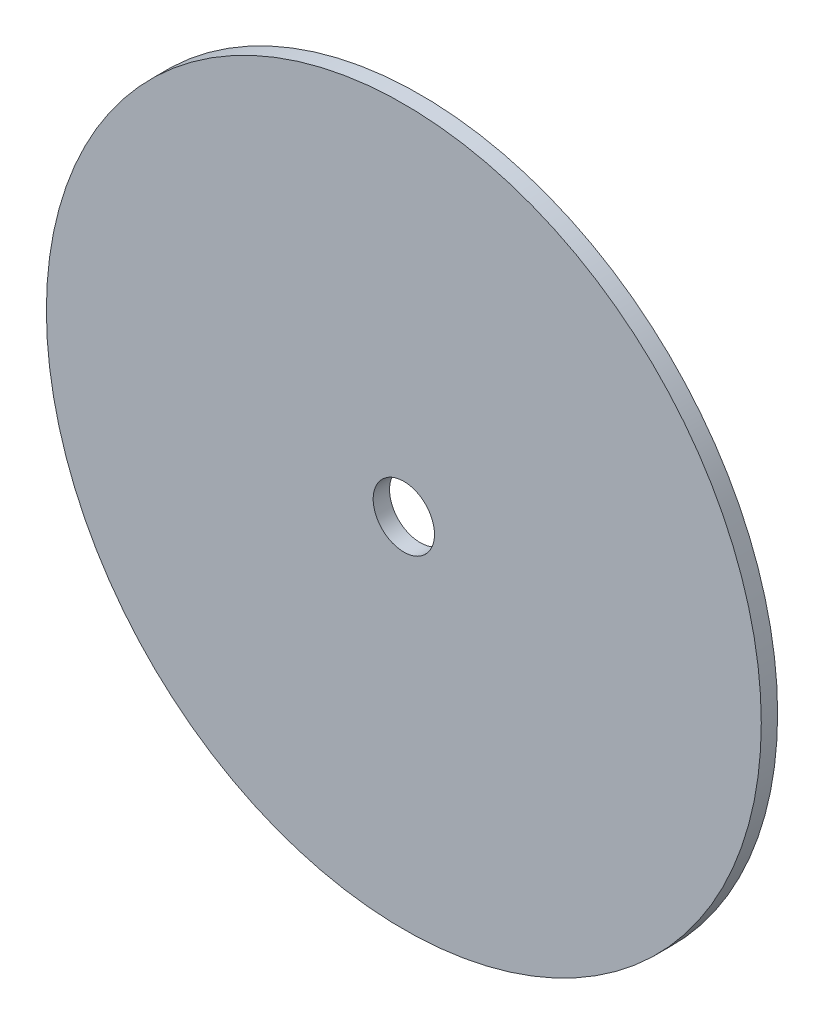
SolidWorks part; units mm, degrees
ref_plane "Alzado" through (0, 0, 0) normal (0, 0, 1) x (1, 0, 0)
ref_plane "Planta" through (0, 0, 0) normal (0, 1, 0) x (1, 0, 0)
ref_plane "Vista lateral" through (0, 0, 0) normal (1, 0, 0) x (0, 0, -1)
sketch "Croquis1" plane through (0, 0, 0) normal (0, 0, 1) x (1, 0, 0)
  circle A0 centre (0, 0) radius 175
  circle A1 centre (0, 0) radius 15
  dimension "D1" = 350
extrude "Saliente-Extruir1" add sketch "Croquis1" along normal blind 8
